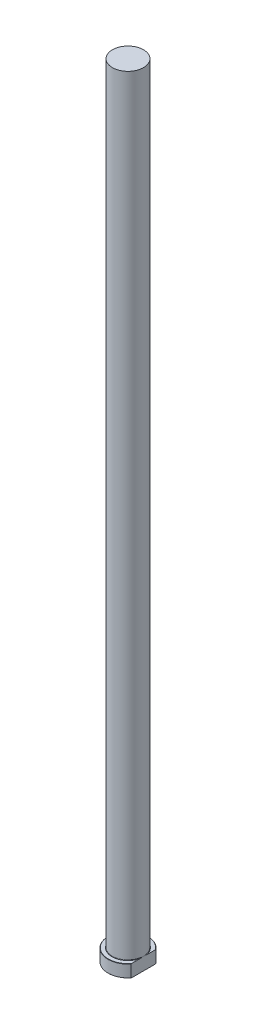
SolidWorks part; units mm, degrees
ref_plane "Front Plane" through (0, 0, 0) normal (0, 0, 1) x (1, 0, 0)
ref_plane "Top Plane" through (0, 0, 0) normal (0, 1, 0) x (1, 0, 0)
ref_plane "Right Plane" through (0, 0, 0) normal (1, 0, 0) x (0, 0, -1)
sketch "Sketch1" plane through (0, 0, 0) normal (0, 0, 1) x (1, 0, 0)
  line L0 (0, 259.9588) -> (0, -15.1925) construction
  line L1 (0, 0) -> (-16, 0)
  line L2 (-16, 0) -> (-16, 10)
  line L3 (-16, 10) -> (-12.5, 10)
  line L4 (-12.5, 10) -> (-12.5, 630)
  line L5 (-12.5, 630) -> (0, 630)
  line L6 (0, 630) -> (0, 0)
  dimension "L" = 630
  dimension "H" = 32
  dimension "T" = 10
  dimension "D" = 25
revolve "Revolve1" add sketch "Sketch1" angle 360 about L0
chamfer "Chamfer1" distance 0.2 angle 45 2 edges at (0, 10, 16) (0, 0, 16)
fillet "Fillet1" radius 0.3 1 edges at (0, 10, 12.5)
sketch "Sketch2" plane through (0, 0, 0) normal (0, 1, 0) x (1, 0, 0)
  line L0 (12.5, 9.9875) -> (12.5, -9.9875)
  circle A0 centre (0, 0) radius 16 construction
  arc A1 (12.5, -9.9875) -> (12.5, 9.9875) centre (0, 0) ccw
  circle A2 centre (0, 0) radius 12.5 construction
extrude "KEY" cut sketch "Sketch2" along normal through all
